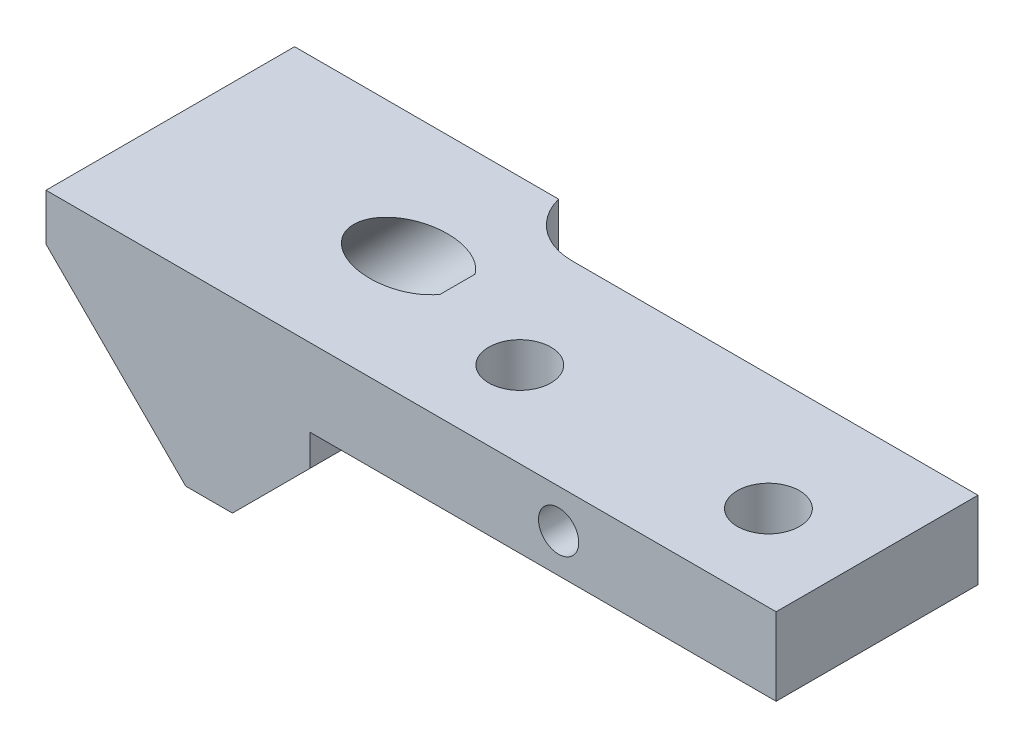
SolidWorks part; units mm, degrees
ref_plane "Front Plane" through (0, 0, 0) normal (0, 0, 1) x (1, 0, 0)
ref_plane "Top Plane" through (0, 0, 0) normal (0, 1, 0) x (1, 0, 0)
ref_plane "Right Plane" through (0, 0, 0) normal (1, 0, 0) x (0, 0, -1)
sketch "Sketch1" plane through (0, 0, 0) normal (0, 0, 1) x (1, 0, 0)
  line L0 (0, 0) -> (-47.625, 0)
  line L1 (-47.625, 0) -> (-47.625, -11.1252)
  line L2 (-47.625, -11.1252) -> (-60.325, -11.1252)
  line L3 (-60.325, -11.1252) -> (-79.375, 7.9248)
  line L4 (-79.375, 7.9248) -> (0, 7.9248)
  line L5 (0, 7.9248) -> (0, 0)
  line L6 (-64.8151, -6.6351) -> (-51.3265, 6.8535) construction
  line L7 (-74.5998, 7.9248) -> (-74.5998, 3.1496)
  circle A0 centre (-22.225, 3.9624) radius 2.0574
  dimension "D10" = 4.1148
  dimension "D1" = 7.9248
  dimension "D2" = 45
  dimension "D3" = 19.05
  dimension "D4" = 47.625
  dimension "D5" = 12.7
  dimension "D6" = 6.35
  dimension "D7" = 4.7752
  dimension "D8" = 3.9624
  dimension "D9" = 22.225
sketch "Sketch2" plane through (0, 0, 0) normal (0, 0, 1) x (1, 0, 0)
  line L0 (-60.325, -11.1252) -> (-79.375, 7.9248) construction
  line L1 (-79.375, 7.9248) -> (0, 7.9248) construction
  line L2 (0, 7.9248) -> (0, 0) construction
  line L3 (0, 0) -> (-47.625, 0) construction
  line L4 (-47.625, 0) -> (-47.625, -11.1252) construction
  line L5 (-47.625, -11.1252) -> (-60.325, -11.1252) construction
  line L6 (-60.325, -11.1252) -> (-79.375, 7.9248)
  line L7 (-79.375, 7.9248) -> (0, 7.9248)
  line L8 (0, 7.9248) -> (0, 0)
  line L9 (0, 0) -> (-47.625, 0)
  line L10 (-47.625, 0) -> (-47.625, -11.1252)
  line L11 (-47.625, -11.1252) -> (-60.325, -11.1252)
extrude "Boss-Extrude1" add sketch "Sketch2" along normal mid plane 25.4
sketch "Sketch3" plane through (-35.7251, -35.7251, 0) normal (-0.7071, -0.7071, 0) x (0, 0, 1)
  circle A0 centre (0, 41.1395) radius 3.9624
  dimension "D1" = 7.9248
extrude "Cut-Extrude1" cut sketch "Sketch3" against normal blind 24.13
sketch "Sketch4" plane through (0, 0, 0) normal (0, 1, 0) x (1, 0, 0)
  circle A0 centre (-9.525, -3.9624) radius 3.175
  circle A1 centre (-34.925, -3.9624) radius 3.175
  dimension "D1" = 6.35
  dimension "D2" = 25.4
  dimension "D3" = 3.9624
  dimension "D4" = 9.525
extrude "Cut-Extrude2" cut sketch "Sketch4" against normal mid plane 25.4
sketch "Sketch5" plane through (0, 0, 0) normal (0, 0, 1) x (1, 0, 0)
  line L0 (-74.5998, 7.9248) -> (-74.5998, 3.1496) construction
  line L1 (-74.5998, 7.9248) -> (-74.5998, 3.1496)
extrude "Cut-Extrude3" cut sketch "Sketch5" against normal through all and the other way through all flip side to cut
sketch "Sketch6" plane through (0, 0, 0) normal (0, 1, 0) x (1, 0, 0)
  line L0 (0, 7.9248) -> (-41.4734, 7.9248)
  line L1 (0, -12.7) -> (0, 12.7) construction
  line L2 (0, 12.7) -> (-74.5998, 12.7) construction
  line L3 (-47.625, 12.7) -> (0, 12.7)
  line L4 (0, 12.7) -> (0, 7.9248)
  arc A0 (-41.4734, 7.9248) -> (-47.625, 12.7) centre (-41.4734, 14.2748) cw
  dimension "D1" = 6.35
  dimension "D2" = 4.7752
  dimension "D3" = 47.625
extrude "Cut-Extrude4" cut sketch "Sketch6" along normal blind 8.89
sketch "Sketch8" plane through (0, 0, 0) normal (0, 0, 1) x (1, 0, 0)
  circle A0 centre (-22.225, 3.9624) radius 2.0574 construction
  circle A1 centre (-22.225, 3.9624) radius 2.0574
extrude "Cut-Extrude5" cut sketch "Sketch8" along normal blind 17.78
chamfer "Chamfer1" distance 7.9248 angle 45 1 edges at (-47.625, -11.1252, 0)
